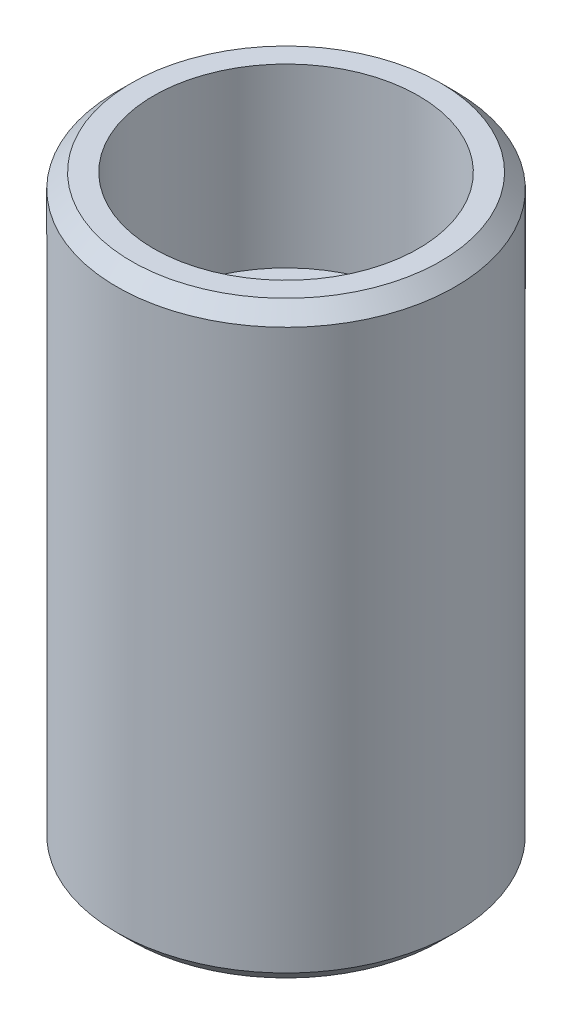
SolidWorks part; units mm, degrees
ref_plane "Plan de face" through (0, 0, 0) normal (0, 0, 1) x (1, 0, 0)
ref_plane "Plan de dessus" through (0, 0, 0) normal (0, 1, 0) x (1, 0, 0)
ref_plane "Plan de droite" through (0, 0, 0) normal (1, 0, 0) x (0, 0, -1)
sketch "Esquisse1" plane through (0, 0, 0) normal (0, 0, 1) x (1, 0, 0)
  line L0 (-5.75, 20) -> (-4.5, 20)
  line L1 (-5.75, 20) -> (-5.75, 0)
  line L2 (-5.75, 0) -> (-2.75, 0)
  line L3 (0, 0) -> (0, 99.0316) construction
  line L4 (-4.5, 20) -> (-4.5, 14)
  line L5 (-4.5, 14) -> (-2.75, 14)
  line L6 (-2.75, 14) -> (-2.75, 0)
  dimension "D1" = 9
  dimension "D2" = 11.5
  dimension "D3" = 20
  dimension "D4" = 6
  dimension "D5" = 2.75
revolve "Révolution1" add sketch "Esquisse1" angle 360 about L3
chamfer "Chanfrein1" distance 0.5 angle 45 3 edges at (0, 0, -5.75) (0, 20, -5.75) (0, 0, -2.75)
